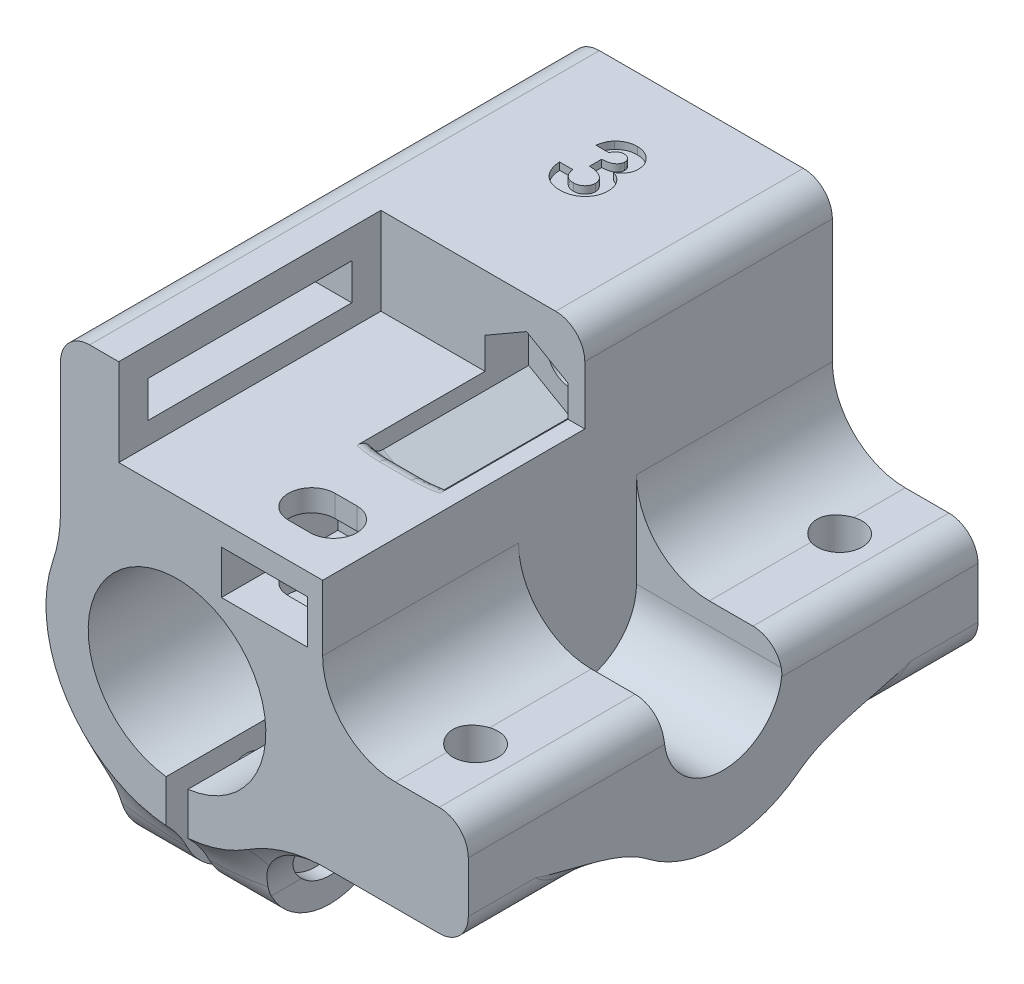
SolidWorks part; units mm, degrees
ref_plane "Спереди" through (0, 0, 0) normal (0, 0, 1) x (1, 0, 0)
ref_plane "Сверху" through (0, 0, 0) normal (0, 1, 0) x (1, 0, 0)
ref_plane "Справа" through (0, 0, 0) normal (1, 0, 0) x (0, 0, -1)
sketch "Эскиз1" plane through (0, 0, 0) normal (0, 0, 1) x (1, 0, 0)
  line L0 (0, 0) -> (0, 21.6321) construction
  line L1 (0, 0) -> (26.3176, 0) construction
  line L2 (18, -6) -> (10.247, -6)
  line L3 (-8, 15) -> (-8, 6.0828)
  line L4 (-6, 17) -> (8, 17)
  line L5 (10, 15) -> (10, 6.5)
  line L6 (15, 1.5) -> (18, 1.5)
  line L7 (20, -4) -> (20, -0.5)
  arc A0 (-8.5263, 2.8813) -> (-8, 6.0828) centre (-18, 6.0828) ccw
  arc A1 (-8.5263, 2.8813) -> (4.8538, -7.5789) centre (0, 0) ccw
  arc A2 (10.247, -6) -> (4.8538, -7.5789) centre (10.247, -16) ccw
  arc A4 (18, -6) -> (20, -4) centre (18, -4) ccw
  arc A5 (20, -0.5) -> (18, 1.5) centre (18, -0.5) ccw
  arc A6 (8, 17) -> (10, 15) centre (8, 15) cw
  arc A7 (-6, 17) -> (-8, 15) centre (-6, 15) ccw
  arc A8 (10, 6.5) -> (15, 1.5) centre (15, 6.5) ccw
  dimension "D2" = 10
  dimension "D4" = 2
  dimension "D5" = 5
  dimension "D6" = 9
  dimension "D12" = 2
  dimension "D13" = 10
  dimension "D3" = 6
  dimension "D7" = 17
  dimension "D8" = 8
  dimension "D9" = 10
  dimension "D10" = 20
  dimension "D11" = 1.5
extrude "Бобышка-Вытянуть1" add sketch "Эскиз1" along normal blind 35
sketch "Эскиз2" plane through (20, 0, 0) normal (1, 0, 0) x (0, 0, -1)
  line L1 (-21.55, 0) -> (-21.55, 6.5)
  line L2 (-35, 6.5) -> (0, 6.5) construction
  line L3 (-21.55, 6.5) -> (-13.45, 6.5)
  line L4 (-13.45, 6.5) -> (-13.45, 0)
  line L5 (0, 0) -> (-35, 0) construction
  line L6 (-35, -4) -> (-35, -0.5) construction
  arc A0 (-21.55, 0) -> (-13.45, 0) centre (-17.5, 0) ccw
  dimension "D1" = 8.1
extrude "Вырез-Вытянуть1" cut sketch "Эскиз2" against normal blind 10
sketch "Эскиз26" plane through (20, 0, 0) normal (1, 0, 0) x (0, 0, -1)
  line L0 (-25.9853, -0.5) -> (-21.519, -0.5)
  line L2 (-13.481, -0.5) -> (-9.0147, -0.5)
  line L3 (-13.481, -0.5) -> (0, -0.5) construction
  arc A0 (-25.9853, -0.5) -> (-9.0147, -0.5) centre (-17.5, 0) ccw
  arc A2 (-21.519, -0.5) -> (-13.481, -0.5) centre (-17.5, 0) ccw
  arc A3 (-21.55, 0) -> (-13.45, 0) centre (-17.5, 0) ccw construction
  dimension "D1" = 17
extrude "Бобышка-Вытянуть6" add sketch "Эскиз26" against normal up to surface (11.0139 mm away)
fillet "Скругление16" radius 5 7 edges at (19.7252, -5.0118, 10.6348) (19.1945, -5.6041, 23.8909) (14.1235, -6, 11.4792) (14.1235, -6, 23.5208) (13.1009, -6.4159, 11.9245) (8.8108, -6.1037, 11.5843) (2.96, -8.4993, 17.6088)
sketch "Эскиз3" plane through (0, 0, 35) normal (0, 0, 1) x (1, 0, 0)
  line L0 (10, 15) -> (10, 11)
  line L3 (10, 11) -> (-4, 11)
  line L4 (-4, 17) -> (-4, 11)
  line L5 (8, 17) -> (-6, 17) construction
  line L6 (-4, 17) -> (8, 17)
  line L7 (10, 6.5) -> (10, 15) construction
  line L10 (0, 0) -> (0, 11.8) construction
  arc A1 (10, 15) -> (8, 17) centre (8, 15) ccw construction
  arc A2 (10, 15) -> (8, 17) centre (8, 15) ccw
  dimension "D1" = 14
  dimension "D3" = 11
extrude "Вырез-Вытянуть2" cut sketch "Эскиз3" against normal blind 18
sketch "Эскиз5" plane through (0, 0, 0) normal (0, 0, -1) x (-1, 0, 0)
  line L0 (0, 0) -> (0, 21.6564) construction
  line L1 (-7.2, 15.7) -> (3.6, 15.7)
  line L2 (-8.2, 14.7) -> (-8.2, 8.3)
  line L3 (-7.2, 7.3) -> (3.6, 7.3)
  line L4 (4.6, 14.7) -> (4.6, 8.3)
  line L6 (-8.2, 11.5) -> (4.6, 11.5) construction
  arc A0 (3.6, 15.7) -> (4.6, 14.7) centre (3.6, 14.7) cw
  arc A1 (3.6, 7.3) -> (4.6, 8.3) centre (3.6, 8.3) ccw
  arc A2 (-8.2, 8.3) -> (-7.2, 7.3) centre (-7.2, 8.3) ccw
  arc A3 (-7.2, 15.7) -> (-8.2, 14.7) centre (-7.2, 14.7) ccw
  point P6 (4.6, 15.7)
  point P13 (-8.2, 15.7)
  dimension "D2" = 1
  dimension "D1" = 12.8
  dimension "D3" = 8.4
  dimension "D4" = 11.5
  dimension "D5" = 8.2
extrude "Вырез-Вытянуть4" cut sketch "Эскиз5" against normal blind 12
ref_plane "Плоскость2" [suppressed] through (0, 0, 25) normal (0, 0, 1) x (1, 0, 0)
sketch "Эскиз6" plane through (0, 0, 25) normal (0, 0, -1) x (-1, 0, 0)
  line L0 (-7, 11.5) -> (4.6, 11.5) construction
  line L2 (4.6, 8.3) -> (4.6, 14.7) construction
  line L3 (0, 0) -> (0, 20.3496) construction
  circle A0 centre (-6, 11.5) radius 1.55
  dimension "D1" = 3.1
  dimension "D2" = 6
extrude "Вырез-Вытянуть5" cut sketch "Эскиз6" along normal through all
sketch "Эскиз7" plane through (0, 0, 25) normal (0, 0, 1) x (1, 0, 0)
  line L1 (6, 8.2091) -> (8.85, 9.8546)
  line L2 (8.85, 9.8546) -> (8.85, 13.1454)
  line L3 (8.85, 13.1454) -> (6, 14.7909)
  line L4 (6, 14.7909) -> (3.15, 13.1454)
  line L5 (3.15, 13.1454) -> (3.15, 9.8546)
  line L6 (3.15, 9.8546) -> (6, 8.2091)
  circle A0 centre (6, 11.5) radius 2.85 construction
  dimension "D1" = 5.7
extrude "Вырез-Вытянуть6" cut sketch "Эскиз7" against normal blind 11
sketch "Эскиз9" plane through (0, 17, 0) normal (0, 1, 0) x (1, 0, 0)
  line L0 (-6, -17.5) -> (20, -17.5) construction
  line L1 (8, 0) -> (-6, 0) construction
  line L3 (0, 0) -> (0, -35) construction
  line L4 (-4, -35) -> (-6, -35) construction
  circle A0 centre (15.5, -5) radius 1.55
  circle A1 centre (15.5, -30) radius 1.55
  dimension "D1" = 3.1
  dimension "D3" = 15.5
  dimension "D2" = 25
  dimension "D4" = 17.5
extrude "Вырез-Вытянуть8" cut sketch "Эскиз9" against normal through all
sketch "Эскиз10" plane through (0, -6, 0) normal (0, -1, 0) x (1, 0, 0)
  line L0 (-9, 17.5) -> (23.6847, 17.5) construction
  line L1 (12.7, 28.3834) -> (15.5, 26.7668)
  line L2 (15.5, 26.7668) -> (18.3, 28.3834)
  line L3 (18.3, 28.3834) -> (18.3, 31.6166)
  line L4 (18.3, 31.6166) -> (15.5, 33.2332)
  line L5 (15.5, 33.2332) -> (12.7, 31.6166)
  line L6 (12.7, 31.6166) -> (12.7, 28.3834)
  line L7 (-9, 35) -> (-9, 0) construction
  line L8 (12.7, 3.3834) -> (12.7, 6.6166)
  line L9 (15.5, 1.7668) -> (12.7, 3.3834)
  line L10 (18.3, 3.3834) -> (15.5, 1.7668)
  line L11 (18.3, 6.6166) -> (18.3, 3.3834)
  line L12 (15.5, 8.2332) -> (18.3, 6.6166)
  line L13 (12.7, 6.6166) -> (15.5, 8.2332)
  circle A0 centre (15.5, 30) radius 2.8 construction
  circle A1 centre (15.5, 5) radius 2.8 construction
  dimension "D1" = 5.6
extrude "Вырез-Вытянуть9" cut sketch "Эскиз10" against normal blind 3
sketch "Эскиз13" plane through (0, 0, 0) normal (0, 0, -1) x (-1, 0, 0)
  circle A0 centre (-6, 11.5) radius 2.85
  dimension "D1" = 5.7
extrude "Вырез-Вытянуть10" cut sketch "Эскиз13" against normal up to surface (12 mm away)
fillet "Скругление3" radius 1 2 edges at (8.2, 13.3118, 6) (8.2, 9.6882, 6)
sketch "Эскиз16" plane through (0, 0, 0) normal (1, 0, 0) x (0, 0, -1)
  line L0 (0, 0) -> (-35, 0) construction
  line L1 (-17.5, -4.05) -> (-17.5, 5.7469) construction
  line L2 (-35, -9) -> (0, -9) construction
  line L3 (-35, 1.5) -> (-35, -0.5) construction
  circle A0 centre (-29.5, -9) radius 1.55 construction
  circle A1 centre (-29.5, -9) radius 4.5
  circle A2 centre (-5.5, -9) radius 4.5
  circle A3 centre (-17.5, 0) radius 4.05 construction
  dimension "D1" = 3.1
  dimension "D2" = 24
  dimension "D3" = 9
extrude "Бобышка-Вытянуть4" add sketch "Эскиз16" along normal mid plane 10
fillet "Скругление7" radius 7 2 edges at (0.4549, -8.9885, 10) (-0.4549, -8.9885, 25)
fillet "Скругление9" radius 7 4 edges at (0.2249, -8.9972, 34) (-0.4549, -8.9885, 1)
fillet "Скругление11" radius 5 4 edges at (-5, -7.4833, 26.9178) (5, -7.4871, 29.5794) (5, -7.4871, 5.4206) (-5, -7.4833, 8.0822)
sketch "Эскиз15" plane through (0, 0, 35) normal (0, 0, 1) x (1, 0, 0)
  circle A0 centre (0, 0) radius 6.1
  dimension "D1" = 12.2
extrude "Вырез-Вытянуть11" cut sketch "Эскиз15" against normal through all
sketch "Эскиз18" plane through (0, 0, 35) normal (0, 0, 1) x (1, 0, 0)
  line L0 (-5, -13.5) -> (5, -13.5) construction
  line L1 (-0.75, 0) -> (0.75, 0)
  line L2 (-0.75, 0) -> (-0.75, -13.5)
  line L3 (-0.75, -13.5) -> (0.75, -13.5)
  line L4 (0.75, 0) -> (0.75, -13.5)
  point P6 (0, 0)
  dimension "D1" = 1.5
extrude "Вырез-Вытянуть13" cut sketch "Эскиз18" against normal through all
ref_plane "Плоскость1" through (-10, 0, 0) normal (1, 0, 0) x (0, 0, -1)
sketch "Эскиз17" plane through (20, 0, 0) normal (1, 0, 0) x (0, 0, -1)
  line L0 (-17.5, -4.05) -> (-17.5, 18.0703) construction
  circle A0 centre (-29.5, -9) radius 1.575
  circle A1 centre (-5.5, -9) radius 1.575
  arc A3 (-21.55, 0) -> (-13.45, 0) centre (-17.5, 0) ccw construction
  dimension "D1" = 3.15
extrude "Вырез-Вытянуть12" cut sketch "Эскиз17" against normal through all
sketch "Эскиз19" plane through (-10, 0, 0) normal (1, 0, 0) x (0, 0, -1)
  line L0 (-17.5, -8.9687) -> (-17.5, 18.2144) construction
  line L1 (-32.7332, -9) -> (-31.1166, -11.8)
  line L2 (-31.1166, -11.8) -> (-27.8834, -11.8)
  line L3 (-27.8834, -11.8) -> (-26.2668, -9)
  line L4 (-26.2668, -9) -> (-27.8834, -6.2)
  line L5 (-27.8834, -6.2) -> (-31.1166, -6.2)
  line L6 (-31.1166, -6.2) -> (-32.7332, -9)
  line L7 (-14.6666, -8.9687) -> (-20.3334, -8.9687) construction
  line L8 (-3.8834, -6.2) -> (-2.2668, -9)
  line L9 (-7.1166, -6.2) -> (-3.8834, -6.2)
  line L10 (-8.7332, -9) -> (-7.1166, -6.2)
  line L11 (-7.1166, -11.8) -> (-8.7332, -9)
  line L12 (-3.8834, -11.8) -> (-7.1166, -11.8)
  line L13 (-2.2668, -9) -> (-3.8834, -11.8)
  circle A0 centre (-29.5, -9) radius 2.8 construction
  circle A1 centre (-5.5, -9) radius 2.8 construction
  dimension "D1" = 5.6
extrude "Вырез-Вытянуть14" cut sketch "Эскиз19" along normal blind 7
sketch "Эскиз24" plane through (20, 0, 0) normal (1, 0, 0) x (0, 0, -1)
  circle A0 centre (-29.5, -9) radius 2.8
  circle A1 centre (-5.5, -9) radius 2.8
  dimension "D1" = 5.6
extrude "Вырез-Вытянуть18" cut sketch "Эскиз24" against normal blind 16
sketch "Эскиз27" plane through (-4, 0, 0) normal (1, 0, 0) x (0, 0, -1)
  line L0 (-35, 17) -> (-35, 11) construction
  line L1 (-33, 15) -> (-19, 15)
  line L2 (-33, 15) -> (-33, 12.5)
  line L3 (-33, 12.5) -> (-19, 12.5)
  line L4 (-19, 15) -> (-19, 12.5)
  line L5 (-17, 17) -> (-17, 11) construction
  line L6 (-17, 17) -> (-35, 17) construction
  dimension "D1" = 2
  dimension "D2" = 2
  dimension "D3" = 2
  dimension "D4" = 2.5
sketch "Эскиз28" plane through (0, 0, 35) normal (0, 0, 1) x (1, 0, 0)
  line L0 (6, 11.5) -> (6, -14.6324) construction
  line L1 (-4, 11) -> (10, 11) construction
  line L2 (3.05, 9.5) -> (8.95, 9.5)
  line L3 (3.05, 9.5) -> (3.05, 6.5)
  line L4 (3.05, 6.5) -> (8.95, 6.5)
  line L5 (8.95, 9.5) -> (8.95, 6.5)
  point P7 (6, 9.5)
  dimension "D1" = 5.9
  dimension "D2" = 3
  dimension "D3" = 1.5
extrude "Вырез-Вытянуть20" cut sketch "Эскиз28" against normal blind 8
sketch "Эскиз29" plane through (0, 11, 0) normal (0, 1, 0) x (1, 0, 0)
  line L0 (6, -17) -> (6, -37.7365) construction
  line L1 (6, -14) -> (6, -25) construction
  line L2 (8, -17) -> (-4, -17) construction
  line L4 (5.25, -31) -> (6.75, -31) construction
  line L5 (5.25, -29.4) -> (6.75, -29.4)
  line L6 (5.25, -32.6) -> (6.75, -32.6)
  line L7 (-4, -35) -> (10, -35) construction
  arc A1 (5.25, -29.4) -> (5.25, -32.6) centre (5.25, -31) ccw
  arc A2 (6.75, -32.6) -> (6.75, -29.4) centre (6.75, -31) ccw
  point P12 (6, -31)
  dimension "D1" = 4
  dimension "D2" = 1.6
  dimension "D3" = 1.5
extrude "Вырез-Вытянуть21" cut sketch "Эскиз29" against normal blind 6
extrude "Вырез-Вытянуть22" cut sketch "Эскиз27" against normal blind 3
fillet "Скругление17" radius 1 2 edges at (7.425, 9.0318, 25) (4.575, 9.0318, 25)
fillet "Скругление18" radius 1 3 edges at (3.158, 11, 25) (8.842, 11, 25) (6, 11, 25)
sketch "Эскиз30" plane through (0, 17, 0) normal (0, 1, 0) x (1, 0, 0)
  text T0 "<b>3</b>" font "Century Gothic" height 5
extrude "Вырез-Вытянуть23" cut sketch "Эскиз30" against normal blind 0.5
